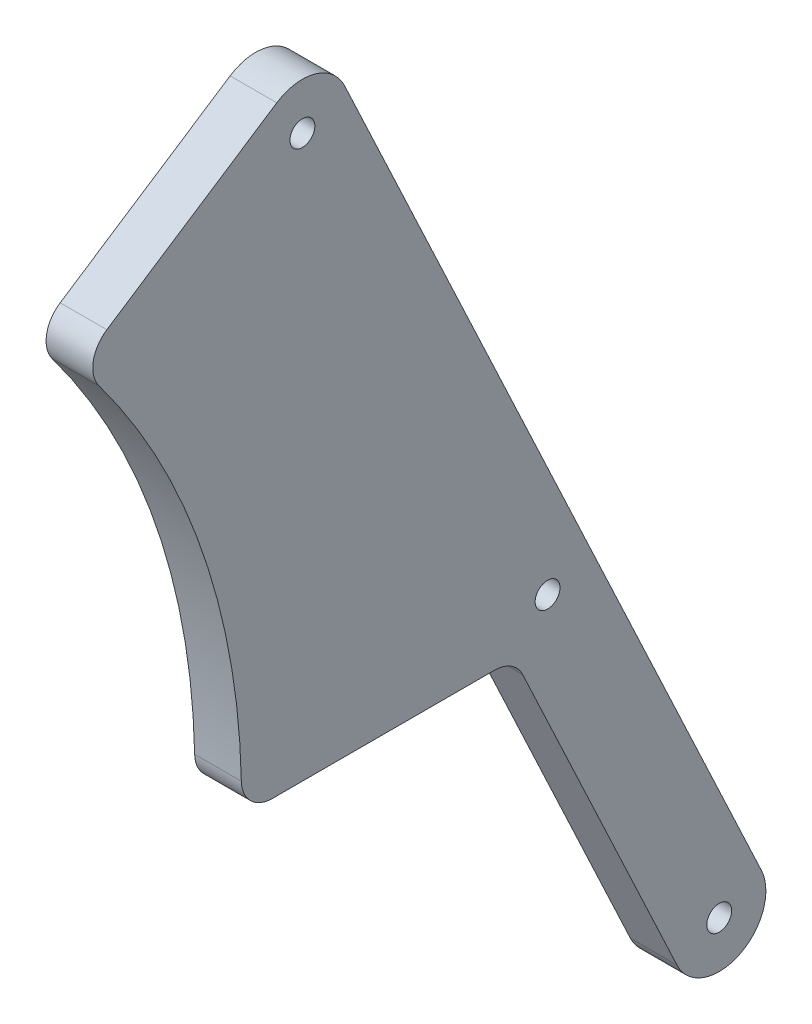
SolidWorks part; units mm, degrees
ref_plane "Alzado" through (0, 0, 0) normal (0, 0, 1) x (1, 0, 0)
ref_plane "Planta" through (0, 0, 0) normal (0, 1, 0) x (1, 0, 0)
ref_plane "Vista lateral" through (0, 0, 0) normal (1, 0, 0) x (0, 0, -1)
sketch "Croquis1" plane through (0, 0, 0) normal (1, 0, 0) x (0, 0, -1)
  line L0 (13023.1104, 4959.4524) -> (13174.4598, 4637.0372)
  line L1 (13087.6874, 4751.2865) -> (13141.3188, 4637.0372)
  line L2 (13141.3188, 4637.0372) -> (13174.4598, 4637.0372)
  line L3 (12997.2541, 4757.0372) -> (13078.6352, 4757.0372)
  line L4 (12944.9318, 4908.1534) -> (13023.1104, 4959.4524)
  arc A0 (13087.6874, 4751.2865) -> (13078.6352, 4757.0372) centre (13078.6352, 4747.0372) ccw
  arc A1 (12997.2541, 4757.0372) -> (12944.9318, 4908.1534) centre (12767.3085, 4762.0372) ccw
extrude "Saliente-Extruir1" add sketch "Croquis1" along normal blind 15
fillet "Redondeo1" radius 15 2 edges at (7.5, 4637.0372, -13174.4598) (7.5, 4959.4524, -13023.1104)
fillet "Redondeo2" radius 15 1 edges at (7.5, 4637.0372, -13141.3188)
sketch "Croquis2" plane through (15, 0, 0) normal (1, 0, 0) x (0, 0, -1)
  line L0 (13016.8807, 4937.4237) -> (13150.8479, 4652.0372) construction
  line L1 (12997.1862, 4769.5372) -> (13095.6906, 4769.5372) construction
  line L2 (12997.2541, 4757.0372) -> (13078.6352, 4757.0372) construction
  circle A0 centre (13016.8807, 4937.4237) radius 4
  circle A1 centre (13150.8479, 4652.0372) radius 4
  arc A2 (12997.2541, 4757.0372) -> (12944.9318, 4908.1534) centre (12767.3085, 4762.0372) ccw construction
  circle A3 centre (13095.6906, 4769.5372) radius 4
  dimension "D1" = 8
  dimension "D2" = 12.5
extrude "Cortar-Extruir1" cut sketch "Croquis2" against normal through all
fillet "Redondeo3" radius 10 1 edges at (7.5, 4908.1534, -12944.9318)
fillet "Redondeo4" radius 10 1 edges at (7.5, 4757.0372, -12997.2541)
